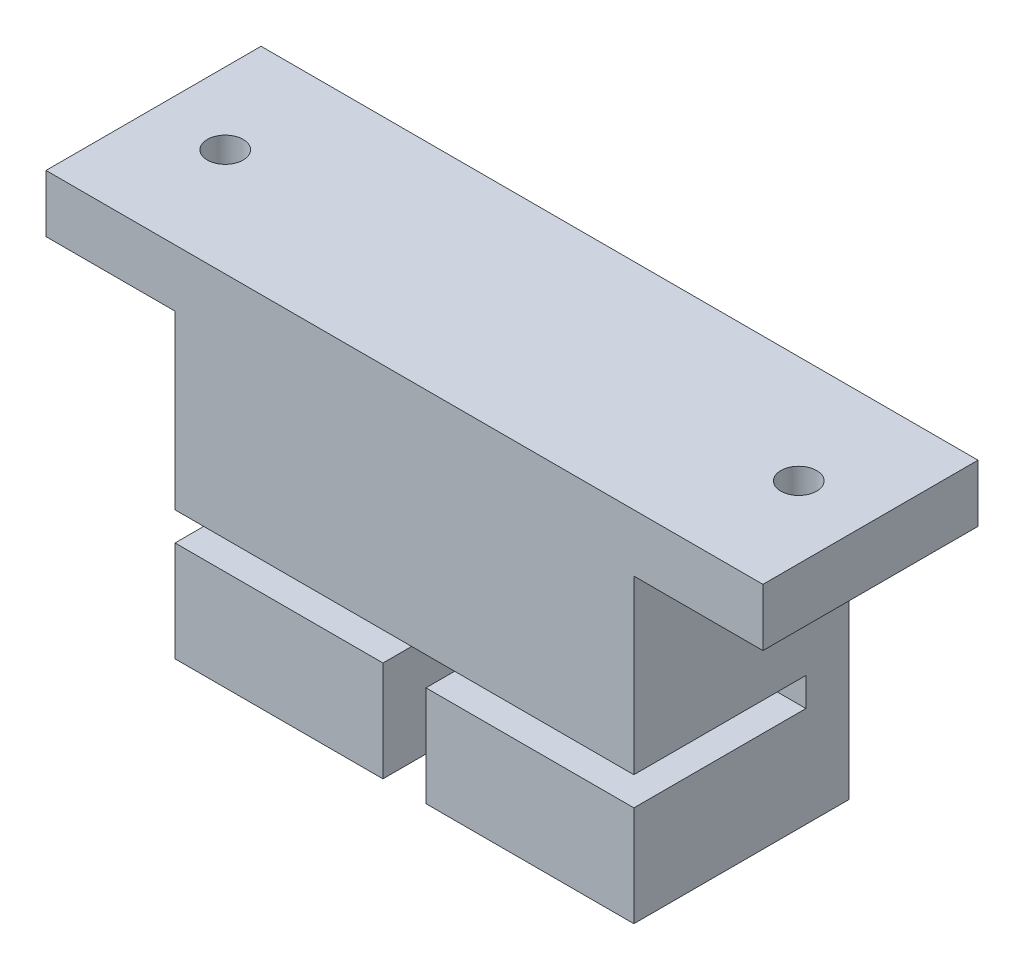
SolidWorks part; units mm, degrees
ref_plane "Alzado" through (0, 0, 0) normal (0, 0, 1) x (1, 0, 0)
ref_plane "Planta" through (0, 0, 0) normal (0, 1, 0) x (1, 0, 0)
ref_plane "Vista lateral" through (0, 0, 0) normal (1, 0, 0) x (0, 0, -1)
sketch "Croquis1" plane through (0, 0, 0) normal (0, 0, 1) x (1, 0, 0)
  line L0 (16, 10.5) -> (25, 10.5)
  line L2 (-16, 10.5) -> (-16, -10.5)
  line L3 (-16, -10.5) -> (16, -10.5)
  line L4 (16, 10.5) -> (16, -10.5)
  line L5 (-16, 10.5) -> (16, -10.5) construction
  line L6 (-16, -10.5) -> (16, 10.5) construction
  line L7 (-25, 10.5) -> (-16, 10.5)
  line L8 (-25, 10.5) -> (-25, 14.5)
  line L9 (-25, 14.5) -> (25, 14.5)
  line L10 (25, 10.5) -> (25, 14.5)
  point P0 (0, 0)
  dimension "D1" = 32
  dimension "D2" = 50
  dimension "D3" = 4
  dimension "D4" = 25
extrude "Saliente-Extruir1" add sketch "Croquis1" along normal blind 15
sketch "Croquis2" plane through (0, 0, 15) normal (0, 0, 1) x (1, 0, 0)
  line L0 (-16, -10.5) -> (16, -10.5) construction
  line L1 (-1.5, -10.5) -> (1.5, -10.5)
  line L2 (-1.5, -10.5) -> (-1.5, -3.5)
  line L4 (1.5, -10.5) -> (1.5, -3.5)
  line L5 (-16, 10.5) -> (-16, -10.5) construction
  line L6 (-16, -1.5) -> (16, -1.5)
  line L7 (-16, -1.5) -> (-16, -3.5)
  line L8 (-16, -3.5) -> (-1.5, -3.5)
  line L9 (16, -1.5) -> (16, -3.5)
  line L10 (16, -10.5) -> (16, 10.5) construction
  line L11 (1.5, -3.5) -> (16, -3.5)
  line L12 (0, -10.5) -> (0, 0) construction
  dimension "D1" = 3
  dimension "D2" = 2
  dimension "D3" = 7
extrude "Cortar-Extruir1" cut sketch "Croquis2" against normal blind 12
sketch "Croquis3" plane through (0, 14.5, 0) normal (0, 1, 0) x (1, 0, 0)
  line L0 (-20, -7.5) -> (20, -7.5) construction
  line L1 (0, 0) -> (0, -7.5) construction
  line L2 (25, 0) -> (-25, 0) construction
  line L3 (0, -7.5) -> (0, -15) construction
  line L4 (25, -15) -> (-25, -15) construction
  circle A0 centre (-20, -7.5) radius 1.25
  circle A1 centre (20, -7.5) radius 1.25
  dimension "D1" = 2.5
  dimension "D2" = 40
extrude "Cortar-Extruir2" cut sketch "Croquis3" against normal blind 12
